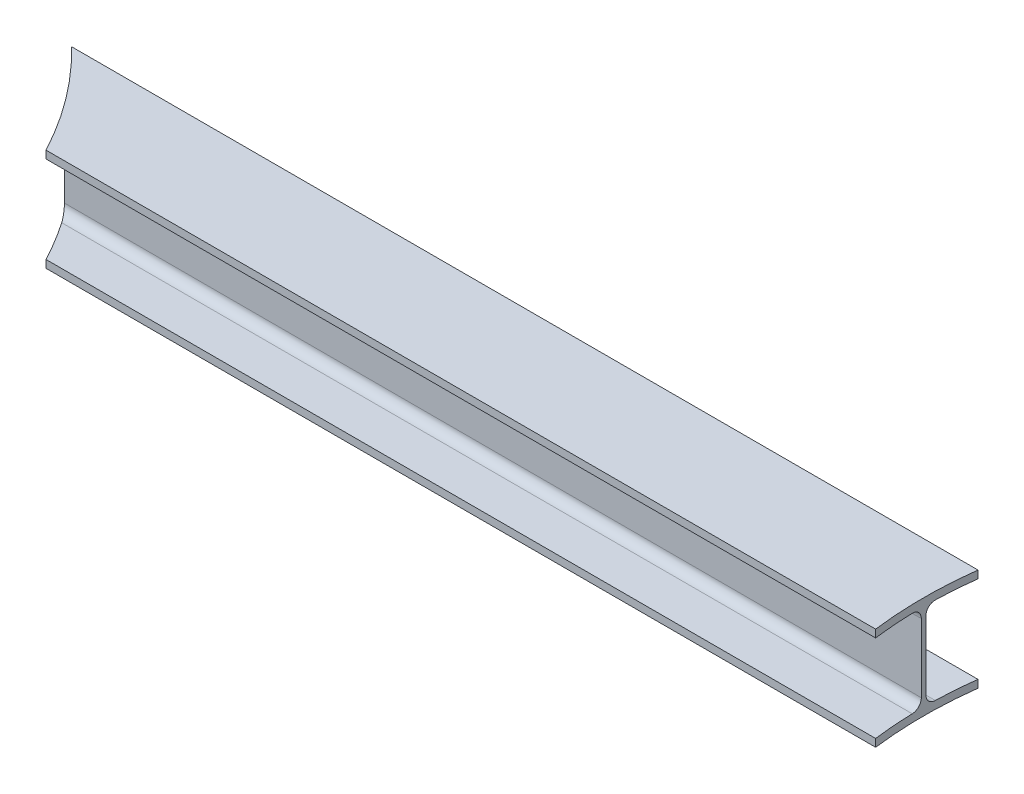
SolidWorks part; units mm, degrees
ref_plane "Ebene vorne" through (0, 0, 0) normal (0, 0, 1) x (1, 0, 0)
ref_plane "Ebene oben" through (0, 0, 0) normal (0, 1, 0) x (1, 0, 0)
ref_plane "Ebene rechts" through (0, 0, 0) normal (1, 0, 0) x (0, 0, -1)
sketch "Skizze1" plane through (0, 0, 0) normal (0, 0, 1) x (1, 0, 0)
  line L0 (0, 0) -> (2363.2704, 0)
other "Strukturbauteil1"
ref_plane "Ebene1" through (0, 0, 0) normal (1, 0, 0) x (0, 0, 1)
sketch "Skizze11" plane through (0, 0, 0) normal (1, 0, 0) x (0, 0, 1)
  line L0 (100, 100) -> (-100, 100)
  line L1 (-100, 100) -> (-100, 85)
  line L2 (-100, 85) -> (-22.5, 85)
  line L3 (-4.5, -67) -> (-4.5, 67)
  line L4 (-22.5, -85) -> (-100, -85)
  line L5 (-100, -85) -> (-100, -100)
  line L6 (-100, -100) -> (100, -100)
  line L7 (100, -100) -> (100, -85)
  line L8 (100, -85) -> (22.5, -85)
  line L9 (4.5, -67) -> (4.5, 67)
  line L10 (22.5, 85) -> (100, 85)
  line L11 (100, 85) -> (100, 100)
  line L13 (0, -100) -> (0, 100) construction
  line L14 (-4.5, 0) -> (4.5, 0) construction
  arc A0 (-4.5, 67) -> (-22.5, 85) centre (-22.5, 67) ccw
  arc A1 (-22.5, -85) -> (-4.5, -67) centre (-22.5, -67) ccw
  arc A2 (4.5, -67) -> (22.5, -85) centre (22.5, -67) ccw
  arc A3 (22.5, 85) -> (4.5, 67) centre (22.5, 67) ccw
  point P21 (-100, -100)
  point P22 (0, 0)
  point P25 (0, -100)
  point P28 (100, -100)
  point P29 (100, 100)
  point P30 (0, 100)
  point P31 (-100, 100)
  point P32 (0, 0)
  dimension "D3" = 18
  dimension "D1" = 200
  dimension "D2" = 200
  dimension "D4" = 15
  dimension "D5" = 9
sketch "Skizze13" plane through (0, 0, 0) normal (0, 1, 0) x (1, 0, 0)
  line L0 (2363.2704, 0) -> (3063.2704, 0) construction
  line L1 (0, 0) -> (2363.2704, 0) construction
  line L2 (2363.2704, 100) -> (2363.2704, -100) construction
  circle A0 centre (3063.2704, 0) radius 800
  dimension "D2" = 1600
  dimension "D1" = 700
extrude "Schnitt-Linear austragen1" cut sketch "Skizze13" against normal through all and the other way through all
other "Formnest1"
other "BEHÄLTER<2>@TuB1"
equation "\"LÄNGE\"=0"
equation "\"BREITE\"=0"
equation "\"HÖHE\"=0"
equation "\"DURCHMESSER\"=0"
equation "\"Stückzahl\"= 1"
